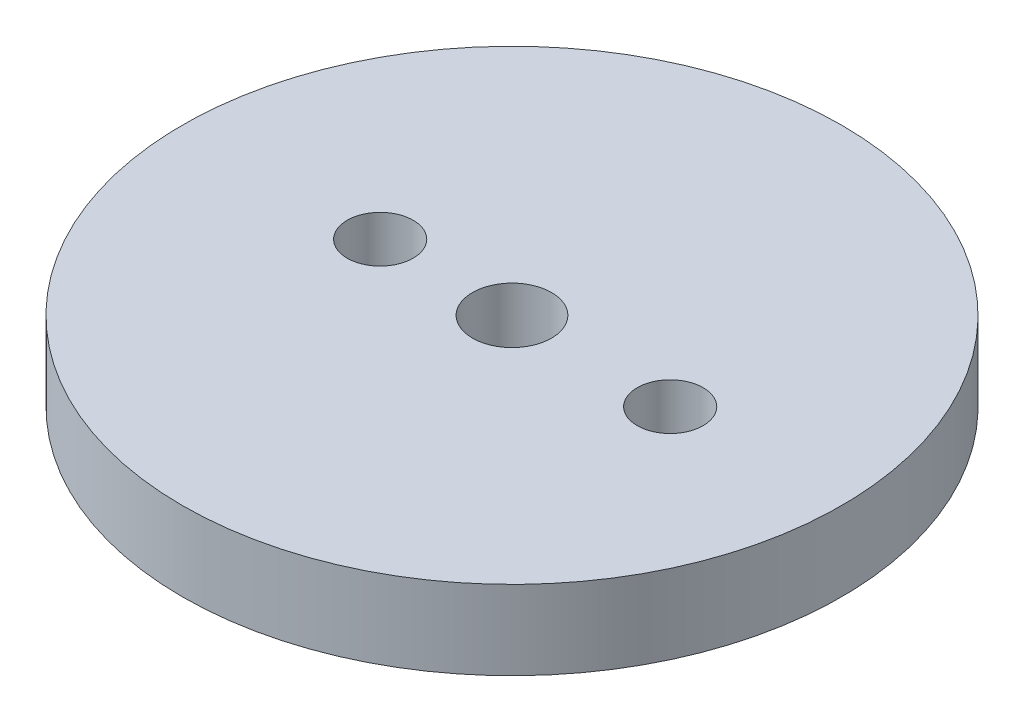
SolidWorks part; units mm, degrees
ref_plane "Front Plane" through (0, 0, 0) normal (0, 0, 1) x (1, 0, 0)
ref_plane "Top Plane" through (0, 0, 0) normal (0, 1, 0) x (1, 0, 0)
ref_plane "Right Plane" through (0, 0, 0) normal (1, 0, 0) x (0, 0, -1)
sketch "Sketch1" plane through (0, 0, 0) normal (0, 1, 0) x (1, 0, 0)
  circle A0 centre (0, 0) radius 25
  circle A1 centre (0, 0) radius 3
  dimension "D1" = 6
  dimension "D2" = 50
extrude "Extrude1" add sketch "Sketch1" along normal blind 6
sketch "Sketch2" plane through (0, 6, 0) normal (0, 1, 0) x (1, 0, 0)
  line L0 (25, 0) -> (-25, 0) construction
  circle A0 centre (0, 0) radius 25 construction
  circle A1 centre (0, 0) radius 3 construction
  point P5 (12, 0)
  point P6 (-10, 0)
  dimension "D1" = 10
  dimension "D2" = 12
hole_wizard "M6 Tapped Hole1" positions "3DSketch1" profile "Sketch3" tap size "M6" standard "ISO"
sketch3d "3DSketch1"
  point P0 (-10, 6, 0)
  point P3 (12, 6, 0)
sketch "Sketch3" plane through (-10, 6, 0) normal (1, 0, 0) x (0, 0, 1)
  line L0 (0, 0) -> (0, 6)
  line L1 (0, 6) -> (2.5, 6)
  line L2 (2.5, 6) -> (2.5, 0)
  line L5 (2.5, 0) -> (0, 0)
  line L11 (0, -6.35) -> (0, 107.95) construction
  dimension "Thru Tap Drill Dia." = 5
  dimension "Thru Tap Drill Depth" = 6
